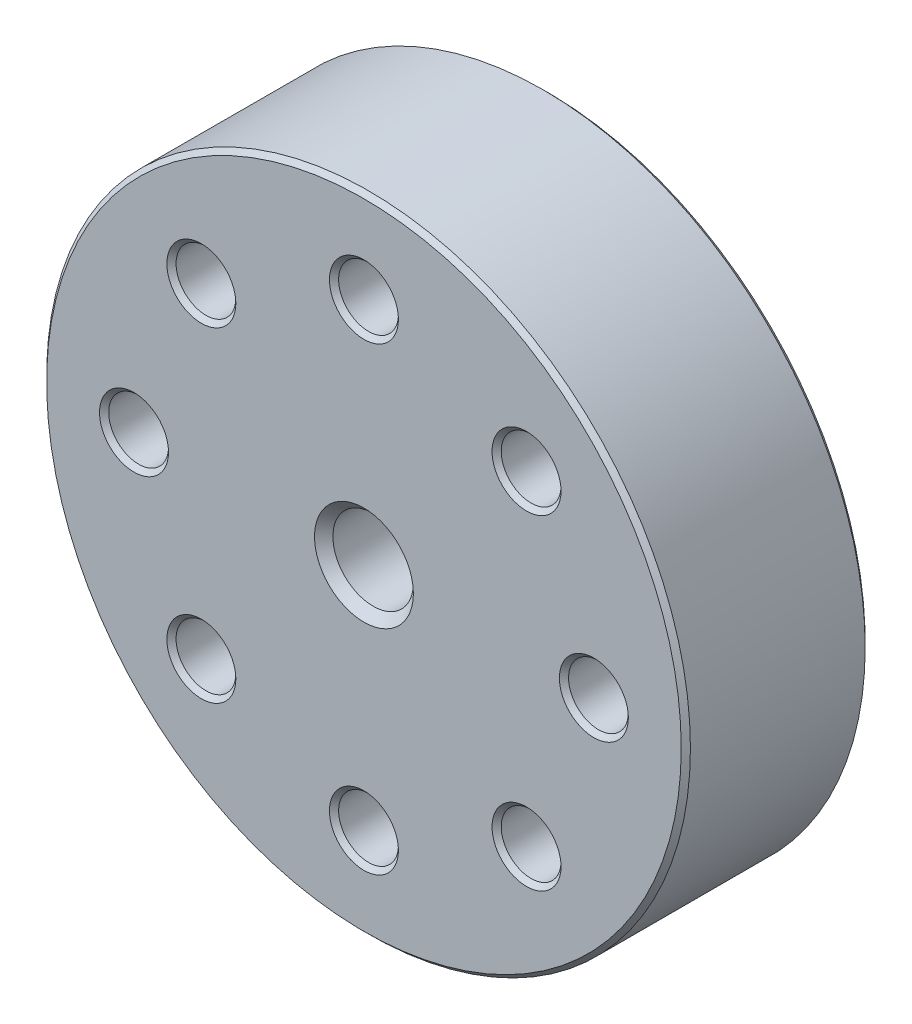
SolidWorks part; units mm, degrees
ref_plane "Спереди" through (0, 0, 0) normal (0, 0, 1) x (1, 0, 0)
ref_plane "Сверху" through (0, 0, 0) normal (0, 1, 0) x (1, 0, 0)
ref_plane "Справа" through (0, 0, 0) normal (1, 0, 0) x (0, 0, -1)
sketch "Эскиз1" plane through (0, 0, 0) normal (1, 0, 0) x (0, 0, -1)
  line L0 (-115.6693, 0) -> (111.3272, 0) construction
  line L1 (0, 87.2043) -> (0, -96.371) construction
  line L2 (0, 0) -> (0, -35)
  line L3 (0, -35) -> (20, -35)
  line L4 (20, -35) -> (20, -4.25)
  line L5 (20, -4.25) -> (23, -4.25)
  line L6 (23, -4.25) -> (23, -5)
  line L7 (23, -5) -> (39, -5)
  line L8 (39, -5) -> (39, 0)
  line L9 (39, 0) -> (0, 0)
  dimension "D1" = 70
  dimension "D2" = 20
  dimension "D3" = 39
  dimension "D4" = 16
  dimension "D5" = 10
  dimension "D6" = 8.5
revolve "Повернуть1" add sketch "Эскиз1" angle 360 about L0
sketch "Эскиз2" plane through (0, 0, -39) normal (0, 0, -1) x (-1, 0, 0)
  circle A0 centre (0, 0) radius 1.5
  dimension "D1" = 3
extrude "Вырез-Вытянуть1" cut sketch "Эскиз2" against normal through all
sketch "Эскиз3" plane through (0, 0, 0) normal (0, 0, 1) x (1, 0, 0)
  circle A0 centre (0, 0) radius 4.375
  dimension "D1" = 8.75
extrude "Вырез-Вытянуть2" cut sketch "Эскиз3" against normal blind 16
sketch "Эскиз4" plane through (0, 0, -39) normal (0, 0, -1) x (-1, 0, 0)
  circle A0 centre (0, 0) radius 4
  dimension "D1" = 8
extrude "Вырез-Вытянуть3" cut sketch "Эскиз4" against normal blind 5 flip side to cut
sketch "Эскиз5" plane through (0, 0, 0) normal (0, 0, 1) x (1, 0, 0)
  line L0 (0, 37.0639) -> (0, -15.5121) construction
  circle A0 centre (0, 0) radius 25
  circle A1 centre (0, 25) radius 3.25
  dimension "D1" = 50
  dimension "D2" = 6.5
extrude "Вырез-Вытянуть4" cut sketch "Эскиз5" against normal through all contours A1
chamfer "Фаска1" distance 0.5 angle 45 2 edges at (-3.25, 25, -20) (3.25, 25, 0)
pattern_circular "Круговой массив1" count 8 over 360 about axis through (0, 0, 0) along (0, 0, 1) of "Фаска1", "Вырез-Вытянуть4"
chamfer "Фаска2" distance 0.5 angle 45 6 edges at (5, 0, -23) (4.25, 0, -20) (-1.5, 0, -39) (-4, 0, -39) (35, 0, 0) (35, 0, -20)
chamfer "Фаска3" distance 1 angle 45 1 edges at (4.375, 0, 0)
sketch "Эскиз6" plane through (0, 0, 0) normal (0, 0, 1) x (1, 0, 0)
  line L0 (0, 37.8461) -> (0, -38.4544) construction
  line L1 (-40.3662, 0) -> (44.6245, 0) construction
  line L2 (0, 0) -> (34.4569, 34.4569) construction
  line L3 (15.9659, 38.5229) -> (-16.2036, -39.1413) construction
  dimension "D1" = 22.5
sketch "Эскиз7" plane through (0, 0, -39) normal (0, 0, -1) x (-1, 0, 0)
  circle A0 centre (0, 0) radius 5.5004
extrude "Вырез-Вытянуть5" cut sketch "Эскиз7" against normal blind 5
chamfer "Фаска4" distance 1 angle 45 1 edges at (-5, 0, -34)
